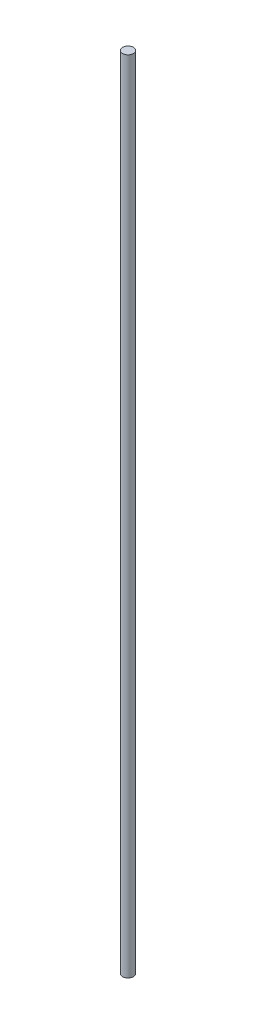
SolidWorks part; units mm, degrees
ref_plane "Plan1" through (0, 0, 0) normal (0, 0, 1) x (1, 0, 0)
ref_plane "Plan2" through (0, 0, 0) normal (0, 1, 0) x (1, 0, 0)
ref_plane "Plan3" through (0, 0, 0) normal (1, 0, 0) x (0, 0, -1)
sketch "Esquisse1" plane through (0, 0, 0) normal (0, 0, 1) x (1, 0, 0)
  line L0 (0, 66.4223) -> (0, -45.2096) construction
  line L2 (0, -92.5) -> (1.25, -92.5)
  line L3 (0, -92.5) -> (0, 92.5)
  line L4 (0, 92.5) -> (1.25, 92.5)
  line L5 (1.25, -92.5) -> (1.25, 92.5)
  dimension "D1" = 185
  dimension "D2" = 1.25
revolve "Révolution1" add sketch "Esquisse1" angle 360 about L0
